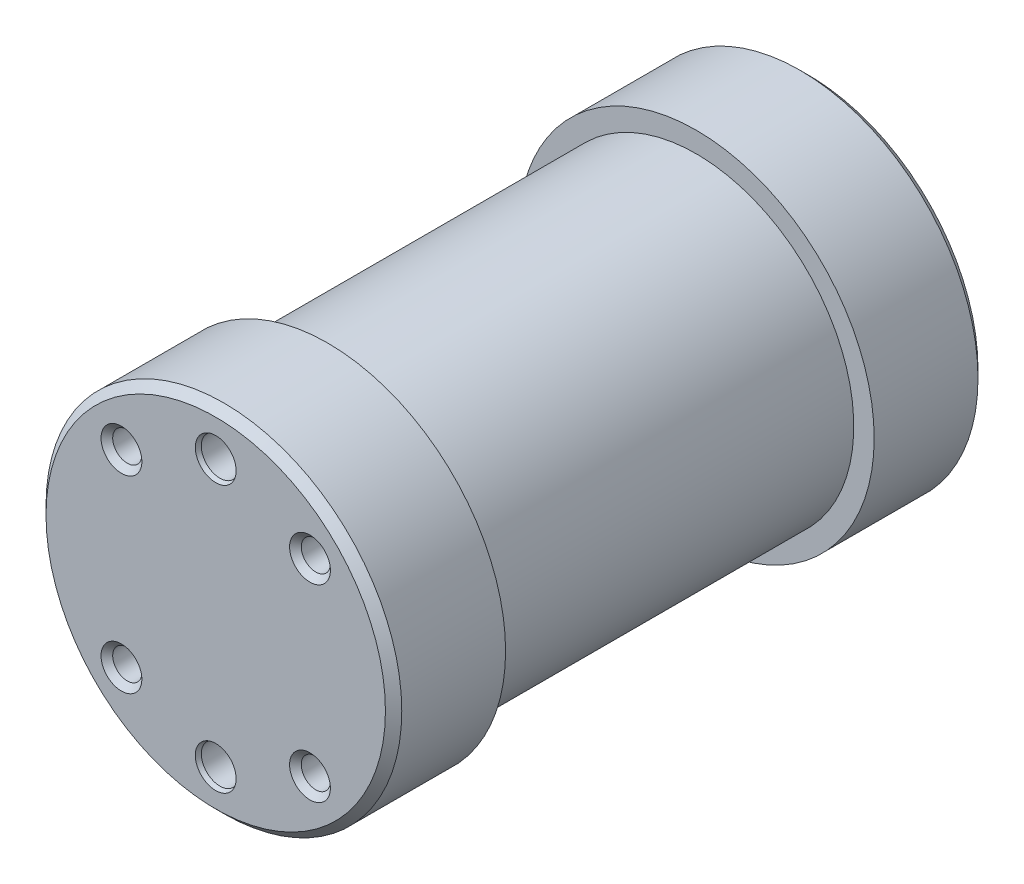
SolidWorks part; units mm, degrees
ref_plane "Front Plane" through (0, 0, 0) normal (0, 0, 1) x (1, 0, 0)
ref_plane "Top Plane" through (0, 0, 0) normal (0, 1, 0) x (1, 0, 0)
ref_plane "Right Plane" through (0, 0, 0) normal (1, 0, 0) x (0, 0, -1)
sketch "Sketch2" plane through (0, 0, 0) normal (0, 1, 0) x (1, 0, 0)
  line L0 (0, 25.4) -> (0, -25.4)
  line L1 (0, -25.4) -> (15.25, -25.4)
  line L2 (15.25, -25.4) -> (15.25, -15.8)
  line L3 (15.25, -15.8) -> (13.5, -15.8)
  line L4 (13.5, -15.8) -> (13.5, 15.8)
  line L5 (13.5, 15.8) -> (15.25, 15.8)
  line L6 (15.25, 15.8) -> (15.25, 25.4)
  line L7 (15.25, 25.4) -> (0, 25.4)
  point P3 (0, 0)
  dimension "D1" = 15.25
  dimension "D2" = 9.6
  dimension "D3" = 50.8
  dimension "D4" = 13.5
revolve "Revolve1" add sketch "Sketch2" angle 360 about L0
chamfer "Chamfer1" distance 0.7 angle 45 2 edges at (-15.25, 0, -25.4) (-15.25, 0, 25.4)
hole_wizard "M3x0.5 Tapped Hole1" positions "Sketch4" profile "Sketch3" tap size "M3x0.5" standard "Ansi Metric"
sketch "Sketch4" plane through (0, 0, 25.4) normal (0, 0, 1) x (1, 0, 0)
  line L2 (0, 0) -> (-16.9331, 0) construction
  line L4 (-8.0822, -8.0822) -> (0, 0) construction
  point P0 (-8.0822, -8.0822)
  dimension "D1" = 11.43
  dimension "D2" = 45
sketch "Sketch3" plane through (-8.0822, -8.0822, 25.4) normal (1, 0, 0) x (0, -1, 0)
  line L0 (0, 0) -> (0, 8.7511)
  line L1 (0, 8.7511) -> (1.25, 8)
  line L2 (1.25, 8) -> (1.25, 0.5)
  line L3 (1.25, 0.5) -> (1.75, 0)
  line L5 (1.75, 0) -> (0, 0)
  line L6 (-1.25, 0.5) -> (-1.75, 0) construction
  line L10 (0, 8.7511) -> (-1.25, 8) construction
  line L11 (0, -6.35) -> (0, 107.95) construction
  dimension "Tap Drill Dia." = 2.5
  dimension "Tap Drill Depth" = 8
  dimension "Near C'Sink Dia." = 3.5
  dimension "Near C'Sink Angle" = 90
  dimension "Drill Angle" = 118
pattern_circular "CirPattern1" count 4 over 360 about axis through (0, 0, 0) along (0, 0, 1) of "M3x0.5 Tapped Hole1"
hole_wizard "M3 Clearance Hole1" positions "3DSketch1" profile "Sketch5" hole size "M3" standard "Ansi Metric"
sketch3d "3DSketch1"
  point P0 (0, 11.43, 25.4)
sketch "Sketch5" plane through (0, 11.43, 25.4) normal (1, 0, 0) x (0, -1, 0)
  line L0 (0, 0) -> (0, 8.9614)
  line L1 (0, 8.9614) -> (1.6, 8)
  line L2 (1.6, 8) -> (1.6, 0.3621)
  line L3 (1.6, 0.3621) -> (1.75, 0)
  line L5 (1.75, 0) -> (0, 0)
  line L6 (-1.6, 0.3621) -> (-1.75, 0) construction
  line L10 (0, 8.9614) -> (-1.6, 8) construction
  line L11 (0, -6.35) -> (0, 107.95) construction
  dimension "Hole Dia." = 3.2
  dimension "Hole Depth" = 8
  dimension "Near C'Sink Dia." = 3.5
  dimension "Near C'Sink Angle" = 45
  dimension "Drill Angle" = 118
mirror "Mirror1" about plane through (0, 0, 0) normal (0, 1, 0) of "M3 Clearance Hole1"
mirror "Mirror2" about plane through (0, 0, 0) normal (0, 0, 1) of "Mirror1", "M3 Clearance Hole1", "CirPattern1", "M3x0.5 Tapped Hole1"
